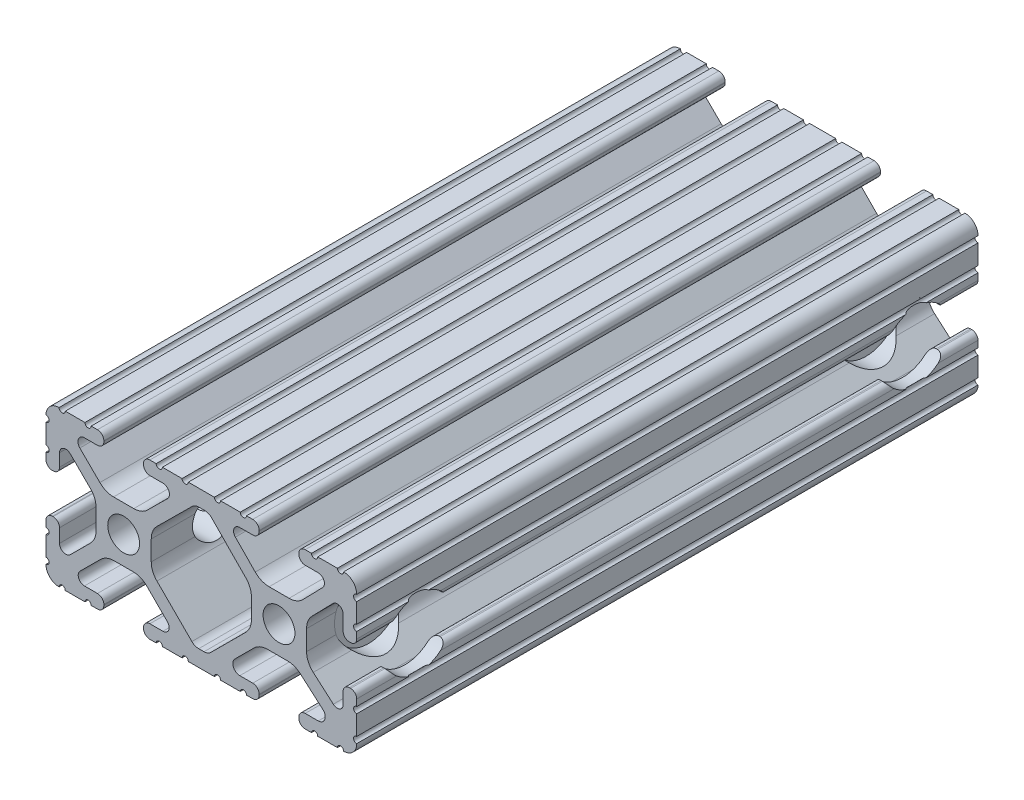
SolidWorks part; units mm, degrees
ref_plane "Front" through (0, 0, 0) normal (0, 0, 1) x (1, 0, 0)
ref_plane "Top" through (0, 0, 0) normal (0, 1, 0) x (1, 0, 0)
ref_plane "Right" through (0, 0, 0) normal (1, 0, 0) x (0, 0, -1)
sketch "Sketch1" plane through (0, 0, 0) normal (0, 0, 1) x (1, 0, 0)
  line L0 (-20.1324, -9.4742) -> (-5.2676, -9.4742) construction
  line L16 (-7.2595, -3.8694) -> (-1.5457, -9.5728)
  line L17 (-8.1915, 1.6223) -> (-8.1915, -1.6223)
  line L18 (-1.504, 9.5765) -> (-7.252, 3.8768)
  line L19 (0.5515, 10.033) -> (-0.3952, 10.033)
  line L20 (7.2829, 3.8459) -> (1.6756, 9.5611)
  line L21 (8.1915, -1.6223) -> (8.1915, 1.6223)
  line L22 (1.5457, -9.5728) -> (7.2595, -3.8694)
  line L23 (-0.4332, -10.033) -> (0.4332, -10.033)
  line L136 (18.0171, 12.7) -> (16.9875, 12.7)
  line L137 (15.9385, 11.651) -> (15.9385, 11.5392)
  line L138 (16.9875, 10.4902) -> (19.1164, 10.4902)
  line L139 (19.8441, 8.7652) -> (16.619, 5.4551)
  line L140 (14.3449, 4.4958) -> (11.0833, 4.4958)
  line L141 (8.817, 5.4472) -> (5.5642, 8.7627)
  line L142 (6.2894, 10.4902) -> (8.4125, 10.4902)
  line L143 (9.4615, 11.5392) -> (9.4615, 11.651)
  line L144 (8.4125, 12.7) -> (7.3829, 12.7)
  line L145 (6.3669, 12.7) -> (3.1496, 12.7)
  line L146 (2.1336, 12.7) -> (-2.1336, 12.7)
  line L147 (-3.1496, 12.7) -> (-6.3669, 12.7)
  line L148 (-7.3829, 12.7) -> (-8.4125, 12.7)
  line L149 (-9.4615, 11.651) -> (-9.4615, 11.5392)
  line L150 (-8.4125, 10.4902) -> (-6.2836, 10.4902)
  line L151 (-5.5326, 8.6661) -> (-8.81, 5.4163)
  line L152 (-11.0455, 4.4958) -> (-14.3545, 4.4958)
  line L153 (-16.59, 5.4163) -> (-19.8674, 8.6661)
  line L154 (-19.1164, 10.4902) -> (-16.9875, 10.4902)
  line L155 (-15.9385, 11.5392) -> (-15.9385, 11.651)
  line L156 (-16.9875, 12.7) -> (-18.0171, 12.7)
  line L157 (-19.0331, 12.7) -> (-22.2504, 12.7)
  line L158 (-25.4, 9.5504) -> (-25.4, 6.3331)
  line L159 (-25.4, 5.3171) -> (-25.4, 4.2375)
  line L160 (-24.401, 3.2385) -> (-24.2392, 3.2385)
  line L161 (-23.1902, 4.2875) -> (-23.1902, 6.3347)
  line L162 (-21.434, 7.0665) -> (-18.148, 3.8082)
  line L163 (-17.2085, 1.5536) -> (-17.2085, -1.6952)
  line L164 (-18.1405, -3.9423) -> (-21.4316, -7.2274)
  line L165 (-23.1902, -6.498) -> (-23.1902, -4.2875)
  line L166 (-24.2392, -3.2385) -> (-24.351, -3.2385)
  line L167 (-25.4, -4.2875) -> (-25.4, -5.3171)
  line L168 (-25.4, -6.3331) -> (-25.4, -9.5504)
  line L169 (-22.2504, -12.7) -> (-19.0331, -12.7)
  line L170 (-18.0171, -12.7) -> (-16.9875, -12.7)
  line L171 (-15.9384, -11.651) -> (-15.9384, -11.5392)
  line L172 (-16.9875, -10.4902) -> (-19.1164, -10.4902)
  line L173 (-19.8341, -8.7551) -> (-16.4966, -5.4237)
  line L174 (-14.2536, -4.4958) -> (-11.1464, -4.4958)
  line L175 (-8.9034, -5.4237) -> (-5.5659, -8.7551)
  line L176 (-6.2836, -10.4902) -> (-8.4125, -10.4902)
  line L177 (-9.4616, -11.5392) -> (-9.4616, -11.651)
  line L178 (-8.4125, -12.7) -> (-7.3829, -12.7)
  line L179 (-6.3669, -12.7) -> (-3.1496, -12.7)
  line L180 (-2.1336, -12.7) -> (2.1336, -12.7)
  line L181 (3.1496, -12.7) -> (6.3669, -12.7)
  line L182 (7.3829, -12.7) -> (8.4125, -12.7)
  line L183 (9.4616, -11.651) -> (9.4616, -11.5392)
  line L184 (8.4125, -10.4902) -> (6.2894, -10.4902)
  line L185 (5.4807, -8.5353) -> (8.5979, -5.4237)
  line L186 (10.8409, -4.4958) -> (14.1026, -4.4958)
  line L187 (16.1879, -5.2766) -> (19.8682, -8.4822)
  line L188 (19.1164, -10.4902) -> (16.9875, -10.4902)
  line L189 (15.9384, -11.5392) -> (15.9384, -11.651)
  line L190 (16.9875, -12.7) -> (18.0171, -12.7)
  line L191 (19.0331, -12.7) -> (22.2504, -12.7)
  line L192 (25.4, -9.5504) -> (25.4, -6.3331)
  line L193 (25.4, -5.3171) -> (25.4, -4.2375)
  line L194 (24.401, -3.2385) -> (24.1892, -3.2385)
  line L195 (23.1902, -4.2375) -> (23.1902, -6.1559)
  line L196 (21.584, -6.8869) -> (18.2982, -4.025)
  line L197 (17.2085, -1.6308) -> (17.2085, 1.6308)
  line L198 (18.1094, 3.8465) -> (21.5263, 7.3534)
  line L199 (23.1902, 6.6769) -> (23.1902, 4.2375)
  line L200 (24.1892, 3.2385) -> (24.401, 3.2385)
  line L201 (25.4, 4.2375) -> (25.4, 5.3171)
  line L202 (25.4, 6.3332) -> (25.4, 9.5504)
  line L203 (22.2504, 12.7) -> (19.0331, 12.7)
  circle A2 centre (-12.7, 0) radius 2.6035
  circle A4 centre (12.7, 0) radius 2.6035
  arc A18 (-1.5457, -9.5728) -> (-0.4332, -10.033) centre (-0.4332, -8.4582) ccw
  arc A19 (-8.1915, -1.6223) -> (-7.2595, -3.8694) centre (-5.0165, -1.6223) ccw
  arc A20 (-7.252, 3.8768) -> (-8.1915, 1.6223) centre (-5.0165, 1.6223) ccw
  arc A21 (-0.3952, 10.033) -> (-1.504, 9.5765) centre (-0.3952, 8.4582) ccw
  arc A22 (1.6756, 9.5611) -> (0.5515, 10.033) centre (0.5515, 8.4582) ccw
  arc A23 (8.1915, 1.6223) -> (7.2829, 3.8459) centre (5.0165, 1.6223) ccw
  arc A24 (7.2595, -3.8694) -> (8.1915, -1.6223) centre (5.0165, -1.6223) ccw
  arc A25 (0.4332, -10.033) -> (1.5457, -9.5728) centre (0.4332, -8.4582) ccw
  arc A152 (18.0171, 12.7) -> (19.0331, 12.7) centre (18.5251, 12.7) ccw
  arc A153 (16.9875, 12.7) -> (15.9385, 11.651) centre (16.9875, 11.651) ccw
  arc A154 (15.9385, 11.5392) -> (16.9875, 10.4902) centre (16.9875, 11.5392) ccw
  arc A155 (19.8441, 8.7652) -> (19.1164, 10.4902) centre (19.1164, 9.4742) ccw
  arc A156 (14.3449, 4.4958) -> (16.619, 5.4551) centre (14.3449, 7.6708) ccw
  arc A157 (8.817, 5.4472) -> (11.0833, 4.4958) centre (11.0833, 7.6708) ccw
  arc A158 (6.2894, 10.4902) -> (5.5642, 8.7627) centre (6.2894, 9.4742) ccw
  arc A159 (8.4125, 10.4902) -> (9.4615, 11.5392) centre (8.4125, 11.5392) ccw
  arc A160 (9.4615, 11.651) -> (8.4125, 12.7) centre (8.4125, 11.651) ccw
  arc A161 (6.3669, 12.7) -> (7.3829, 12.7) centre (6.8749, 12.7) ccw
  arc A162 (2.1336, 12.7) -> (3.1496, 12.7) centre (2.6416, 12.7) ccw
  arc A163 (-3.1496, 12.7) -> (-2.1336, 12.7) centre (-2.6416, 12.7) ccw
  arc A164 (-7.3829, 12.7) -> (-6.3669, 12.7) centre (-6.8749, 12.7) ccw
  arc A165 (-8.4125, 12.7) -> (-9.4615, 11.651) centre (-8.4125, 11.651) ccw
  arc A166 (-9.4615, 11.5392) -> (-8.4125, 10.4902) centre (-8.4125, 11.5392) ccw
  arc A167 (-5.5326, 8.6661) -> (-6.2836, 10.4902) centre (-6.2836, 9.4235) ccw
  arc A168 (-11.0455, 4.4958) -> (-8.81, 5.4163) centre (-11.0455, 7.6708) ccw
  arc A169 (-16.59, 5.4163) -> (-14.3545, 4.4958) centre (-14.3545, 7.6708) ccw
  arc A170 (-19.1164, 10.4902) -> (-19.8674, 8.6661) centre (-19.1164, 9.4235) ccw
  arc A171 (-16.9875, 10.4902) -> (-15.9385, 11.5392) centre (-16.9875, 11.5392) ccw
  arc A172 (-15.9385, 11.651) -> (-16.9875, 12.7) centre (-16.9875, 11.651) ccw
  arc A173 (-19.0331, 12.7) -> (-18.0171, 12.7) centre (-18.5251, 12.7) ccw
  arc A174 (-23.2664, 12.6998) -> (-22.2504, 12.7) centre (-22.7584, 12.7) ccw
  arc A175 (-23.2664, 12.6998) -> (-25.3998, 10.5664) centre (-23.2918, 10.5918) ccw
  arc A176 (-25.4, 9.5504) -> (-25.3998, 10.5664) centre (-25.4, 10.0584) ccw
  arc A177 (-25.4, 5.3171) -> (-25.4, 6.3331) centre (-25.4, 5.8251) ccw
  arc A178 (-25.4, 4.2375) -> (-24.401, 3.2385) centre (-24.401, 4.2375) ccw
  arc A179 (-24.2392, 3.2385) -> (-23.1902, 4.2875) centre (-24.2392, 4.2875) ccw
  arc A180 (-21.434, 7.0665) -> (-23.1902, 6.3347) centre (-22.1596, 6.3347) ccw
  arc A181 (-17.2085, 1.5536) -> (-18.148, 3.8082) centre (-20.3835, 1.5536) ccw
  arc A182 (-18.1405, -3.9423) -> (-17.2085, -1.6952) centre (-20.3835, -1.6952) ccw
  arc A183 (-23.1902, -6.498) -> (-21.4316, -7.2274) centre (-22.1596, -6.498) ccw
  arc A184 (-23.1902, -4.2875) -> (-24.2392, -3.2385) centre (-24.2392, -4.2875) ccw
  arc A185 (-24.351, -3.2385) -> (-25.4, -4.2875) centre (-24.351, -4.2875) ccw
  arc A186 (-25.4, -6.3331) -> (-25.4, -5.3171) centre (-25.4, -5.8251) ccw
  arc A187 (-25.3998, -10.5664) -> (-25.4, -9.5504) centre (-25.4, -10.0584) ccw
  arc A188 (-25.3998, -10.5664) -> (-23.2664, -12.6998) centre (-23.2918, -10.5918) ccw
  arc A189 (-22.2504, -12.7) -> (-23.2664, -12.6998) centre (-22.7584, -12.7) ccw
  arc A190 (-18.0171, -12.7) -> (-19.0331, -12.7) centre (-18.5251, -12.7) ccw
  arc A191 (-16.9875, -12.7) -> (-15.9384, -11.651) centre (-16.9875, -11.651) ccw
  arc A192 (-15.9384, -11.5392) -> (-16.9875, -10.4902) centre (-16.9875, -11.5392) ccw
  arc A193 (-19.8341, -8.7551) -> (-19.1164, -10.4902) centre (-19.1164, -9.4742) ccw
  arc A194 (-14.2536, -4.4958) -> (-16.4966, -5.4237) centre (-14.2536, -7.6708) ccw
  arc A195 (-8.9034, -5.4237) -> (-11.1464, -4.4958) centre (-11.1464, -7.6708) ccw
  arc A196 (-6.2836, -10.4902) -> (-5.5659, -8.7551) centre (-6.2836, -9.4742) ccw
  arc A197 (-8.4125, -10.4902) -> (-9.4616, -11.5392) centre (-8.4125, -11.5392) ccw
  arc A198 (-9.4616, -11.651) -> (-8.4125, -12.7) centre (-8.4125, -11.651) ccw
  arc A199 (-6.3669, -12.7) -> (-7.3829, -12.7) centre (-6.8749, -12.7) ccw
  arc A200 (-2.1336, -12.7) -> (-3.1496, -12.7) centre (-2.6416, -12.7) ccw
  arc A201 (3.1496, -12.7) -> (2.1336, -12.7) centre (2.6416, -12.7) ccw
  arc A202 (7.3829, -12.7) -> (6.3669, -12.7) centre (6.8749, -12.7) ccw
  arc A203 (8.4125, -12.7) -> (9.4616, -11.651) centre (8.4125, -11.651) ccw
  arc A204 (9.4616, -11.5392) -> (8.4125, -10.4902) centre (8.4125, -11.5392) ccw
  arc A205 (5.4807, -8.5353) -> (6.2894, -10.4902) centre (6.2894, -9.3455) ccw
  arc A206 (10.8409, -4.4958) -> (8.5979, -5.4237) centre (10.8409, -7.6708) ccw
  arc A207 (16.1879, -5.2766) -> (14.1026, -4.4958) centre (14.1026, -7.6708) ccw
  arc A208 (19.1164, -10.4902) -> (19.8682, -8.4822) centre (19.1164, -9.3455) ccw
  arc A209 (16.9875, -10.4902) -> (15.9384, -11.5392) centre (16.9875, -11.5392) ccw
  arc A210 (15.9384, -11.651) -> (16.9875, -12.7) centre (16.9875, -11.651) ccw
  arc A211 (19.0331, -12.7) -> (18.0171, -12.7) centre (18.5251, -12.7) ccw
  arc A212 (23.2664, -12.6998) -> (22.2504, -12.7) centre (22.7584, -12.7) ccw
  arc A213 (23.2664, -12.6998) -> (25.3998, -10.5664) centre (23.2918, -10.5918) ccw
  arc A214 (25.4, -9.5504) -> (25.3998, -10.5664) centre (25.4, -10.0584) ccw
  arc A215 (25.4, -5.3171) -> (25.4, -6.3331) centre (25.4, -5.8251) ccw
  arc A216 (25.4, -4.2375) -> (24.401, -3.2385) centre (24.401, -4.2375) ccw
  arc A217 (24.1892, -3.2385) -> (23.1902, -4.2375) centre (24.1892, -4.2375) ccw
  arc A218 (21.584, -6.8869) -> (23.1902, -6.1559) centre (22.2207, -6.1559) ccw
  arc A219 (17.2085, -1.6308) -> (18.2982, -4.025) centre (20.3835, -1.6308) ccw
  arc A220 (18.1094, 3.8465) -> (17.2085, 1.6308) centre (20.3835, 1.6308) ccw
  arc A221 (23.1902, 6.6769) -> (21.5263, 7.3534) centre (22.2207, 6.6769) ccw
  arc A222 (23.1902, 4.2375) -> (24.1892, 3.2385) centre (24.1892, 4.2375) ccw
  arc A223 (24.401, 3.2385) -> (25.4, 4.2375) centre (24.401, 4.2375) ccw
  arc A224 (25.4, 6.3332) -> (25.4, 5.3171) centre (25.4, 5.8251) ccw
  arc A225 (25.3998, 10.5664) -> (25.4, 9.5504) centre (25.4, 10.0584) ccw
  arc A226 (25.3998, 10.5664) -> (23.2664, 12.6998) centre (23.2918, 10.5918) ccw
  arc A227 (22.2504, 12.7) -> (23.2664, 12.6998) centre (22.7584, 12.7) ccw
extrude "Boss-Extrude1" add sketch "Sketch1" along normal mid plane 101.6
hole_wizard "CBORE for 1/4 Socket Head Cap Screw1" positions "Sketch2" profile "Sketch3" counterbore size "1/4" standard "ANSI Inch"
sketch "Sketch2" plane through (0, 12.7, 0) normal (0, 1, 0) x (1, 0, 0)
  line L0 (12.7141, -41.275) -> (-12.7, -41.275) construction
  line L1 (-12.7, -41.275) -> (-12.7, -50.8) construction
  line L3 (12.7141, -41.275) -> (12.7141, -50.8) construction
  line L5 (14.3449, -50.8) -> (11.0833, -50.8) construction
  line L6 (-11.0455, -50.8) -> (-14.3545, -50.8) construction
  point P0 (12.7141, -41.275)
  point P2 (-12.7, -41.275)
  dimension "D1" = 9.525
sketch "Sketch3" plane through (12.7141, 12.7, 41.275) normal (1, 0, 0) x (0, 0, 1)
  line L0 (0, 0) -> (0, 25.4)
  line L1 (0, 25.4) -> (3.3782, 25.4)
  line L3 (3.3782, 25.4) -> (3.3782, 8.2042)
  line L4 (3.3782, 8.2042) -> (5.5562, 8.2042)
  line L5 (5.5562, 8.2042) -> (5.5562, 0)
  line L7 (5.5562, 0) -> (0, 0)
  line L11 (0, -6.35) -> (0, 107.95) construction
  dimension "Thru Hole Dia." = 6.7564
  dimension "Thru Hole Depth" = 25.4
  dimension "C'Bore Dia." = 11.1125
  dimension "C'Bore Depth" = 8.2042
hole_wizard "CBORE for 1/4 Socket Head Cap Screw2" positions "Sketch4" profile "Sketch5" counterbore size "1/4" standard "ANSI Inch"
sketch "Sketch4" plane through (25.4, 0, 0) normal (1, 0, 0) x (0, 0, -1)
  point P0 (40.6781, 0)
  point P3 (-40.6781, 0)
sketch "Sketch5" plane through (25.4, 0, -40.6781) normal (0, 1, 0) x (0, 0, -1)
  line L0 (0, 0) -> (0, 50.8)
  line L1 (0, 50.8) -> (3.3782, 50.8)
  line L3 (3.3782, 50.8) -> (3.3782, 8.1918)
  line L4 (3.3782, 8.1918) -> (5.5562, 8.1918)
  line L5 (5.5562, 8.1918) -> (5.5562, 0)
  line L7 (5.5562, 0) -> (0, 0)
  line L11 (0, -6.35) -> (0, 107.95) construction
  dimension "Thru Hole Dia." = 6.7564
  dimension "Thru Hole Depth" = 50.8
  dimension "C'Bore Dia." = 11.1125
  dimension "C'Bore Depth" = 8.1918
